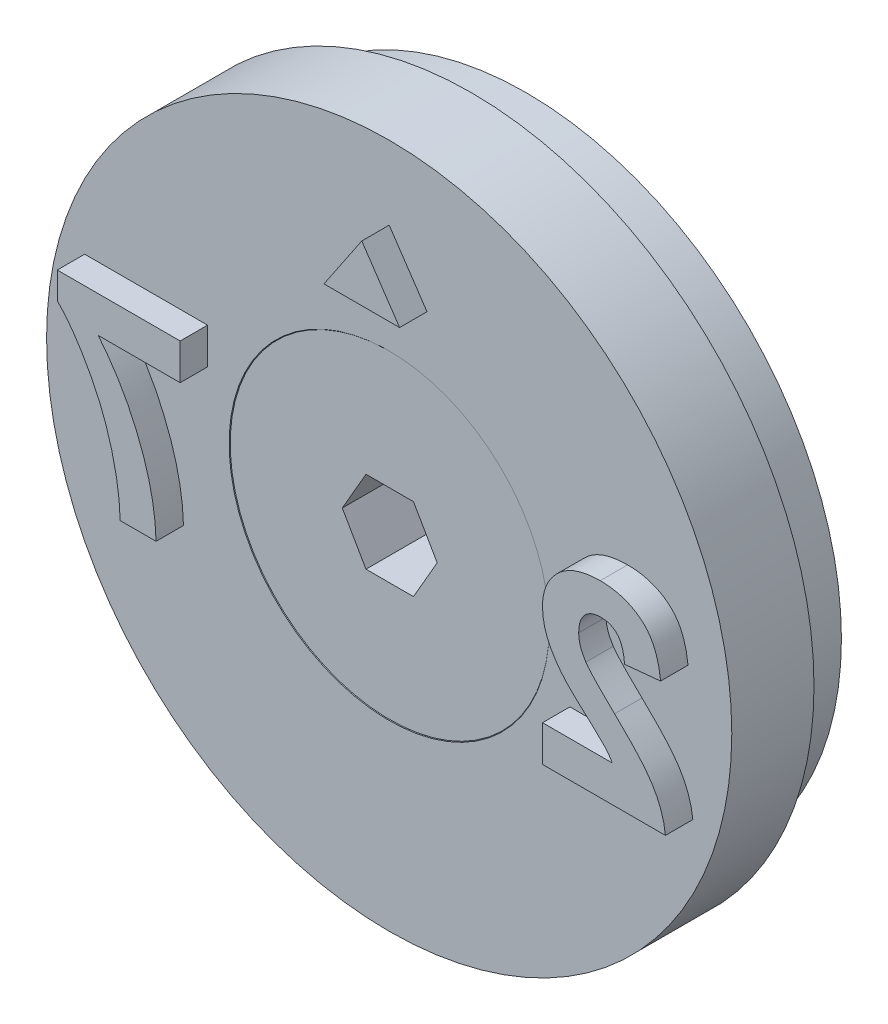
SolidWorks part; units mm, degrees
other "<M5 X .8 FHCS>-<Imported1>"
ref_plane "Front Plane" through (0, 0, 0) normal (0, 0, 1) x (1, 0, 0)
ref_plane "Top Plane" through (0, 0, 0) normal (0, 1, 0) x (1, 0, 0)
ref_plane "Right Plane" through (0, 0, 0) normal (1, 0, 0) x (0, 0, -1)
imported_body "Imported1"
sketch "Sketch1" plane through (0, 0, 0) normal (0, 0, 1) x (1, 0, 0)
  line L0 (0, 9.814) -> (-1.38, 7.768)
  line L1 (-1.38, 7.768) -> (1.38, 7.768)
  line L2 (1.38, 7.768) -> (0, 9.814)
  text T0 "2     7" font "Arial" height 6.858
  dimension "D1" = 3.429
  dimension "D2" = 11.43
extrude "Boss-Extrude1" add sketch "Sketch1" along normal blind 1
other "DeleteFace1"
inserted part "M5 X .8 FHCS"
move or copy body "Body-Move/Copy2" placed by mates yes
